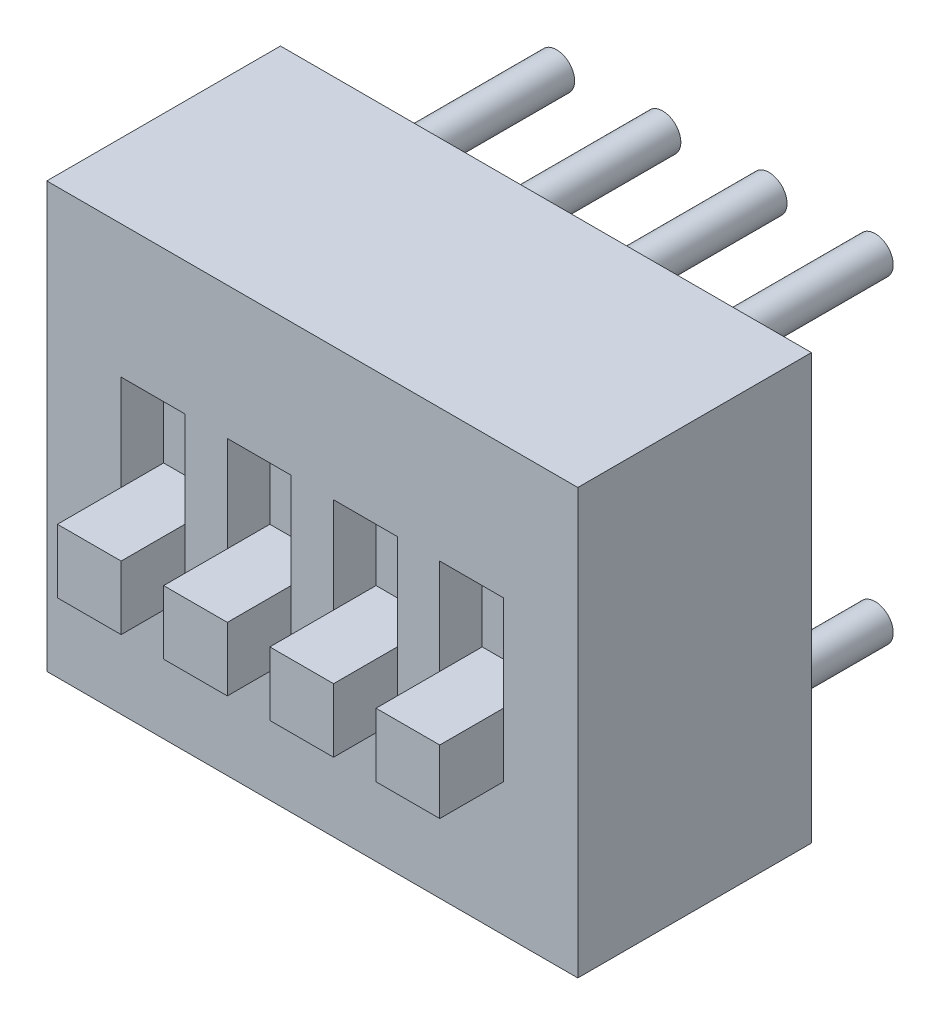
SolidWorks part; units mm, degrees
ref_plane "Front Plane" through (0, 0, 0) normal (0, 0, 1) x (1, 0, 0)
ref_plane "Top Plane" through (0, 0, 0) normal (0, 1, 0) x (1, 0, 0)
ref_plane "Right Plane" through (0, 0, 0) normal (1, 0, 0) x (0, 0, -1)
sketch "Sketch1" plane through (0, 0, 0) normal (0, 0, 1) x (1, 0, 0)
  line L1 (-2.54, -5.08) -> (10.16, -5.08)
  line L2 (-2.54, -5.08) -> (-2.54, 5.08)
  line L3 (-2.54, 5.08) -> (10.16, 5.08)
  line L4 (10.16, -5.08) -> (10.16, 5.08)
extrude "Boss-Extrude1" add sketch "Sketch1" along normal blind 5.588
sketch "Sketch2" plane through (0, 0, 5.588) normal (0, 0, 1) x (1, 0, 0)
  line L1 (-0.762, 1.905) -> (0.762, 1.905)
  line L2 (-0.762, 1.905) -> (-0.762, -1.905)
  line L3 (-0.762, -1.905) -> (0.762, -1.905)
  line L4 (0.762, 1.905) -> (0.762, -1.905)
  line L5 (1.778, 1.905) -> (3.302, 1.905)
  line L6 (1.778, 1.905) -> (1.778, -1.905)
  line L7 (1.778, -1.905) -> (3.302, -1.905)
  line L8 (3.302, 1.905) -> (3.302, -1.905)
  line L9 (4.318, 1.905) -> (5.842, 1.905)
  line L10 (4.318, 1.905) -> (4.318, -1.905)
  line L11 (4.318, -1.905) -> (5.842, -1.905)
  line L12 (5.842, 1.905) -> (5.842, -1.905)
  line L13 (6.858, 1.905) -> (8.382, 1.905)
  line L14 (6.858, 1.905) -> (6.858, -1.905)
  line L15 (6.858, -1.905) -> (8.382, -1.905)
  line L16 (8.382, 1.905) -> (8.382, -1.905)
extrude "Cut-Extrude1" cut sketch "Sketch2" against normal blind 1.016
sketch "Sketch3" plane through (0, 0, 4.572) normal (0, 0, 1) x (1, 0, 0)
  line L0 (0.762, -1.905) -> (0.762, 1.905) construction
  line L1 (-0.762, -1.905) -> (0.762, -1.905)
  line L2 (-0.762, -1.905) -> (-0.762, -0.381)
  line L3 (-0.762, -0.381) -> (0.762, -0.381)
  line L4 (0.762, -1.905) -> (0.762, -0.381)
  line L5 (1.778, 1.905) -> (1.778, -1.905) construction
  line L6 (1.778, -0.381) -> (3.302, -0.381)
  line L7 (1.778, -0.381) -> (1.778, -1.905)
  line L8 (1.778, -1.905) -> (3.302, -1.905)
  line L9 (3.302, -0.381) -> (3.302, -1.905)
  line L10 (4.318, 1.905) -> (4.318, -1.905) construction
  line L11 (4.318, -0.381) -> (5.842, -0.381)
  line L12 (4.318, -0.381) -> (4.318, -1.905)
  line L13 (4.318, -1.905) -> (5.842, -1.905)
  line L14 (5.842, -0.381) -> (5.842, -1.905)
  line L15 (6.858, 1.905) -> (6.858, -1.905) construction
  line L16 (6.858, -0.381) -> (8.382, -0.381)
  line L17 (6.858, -0.381) -> (6.858, -1.905)
  line L18 (6.858, -1.905) -> (8.382, -1.905)
  line L19 (8.382, -0.381) -> (8.382, -1.905)
extrude "Boss-Extrude2" add sketch "Sketch3" along normal blind 2.54 separate body
sketch "Sketch4" plane through (0, 0, 0) normal (0, 0, -1) x (-1, 0, 0)
  circle A0 centre (0, 3.81) radius 0.4318
  circle A1 centre (0, -3.81) radius 0.4318
  circle A2 centre (-2.54, -3.81) radius 0.4318
  circle A3 centre (-5.08, -3.81) radius 0.4318
  circle A4 centre (-7.62, -3.81) radius 0.4318
  circle A13 centre (-2.54, 3.81) radius 0.4318
  circle A14 centre (-5.08, 3.81) radius 0.4318
  circle A15 centre (-7.62, 3.81) radius 0.4318
extrude "Boss-Extrude3" add sketch "Sketch4" along normal blind 4.064 separate body
